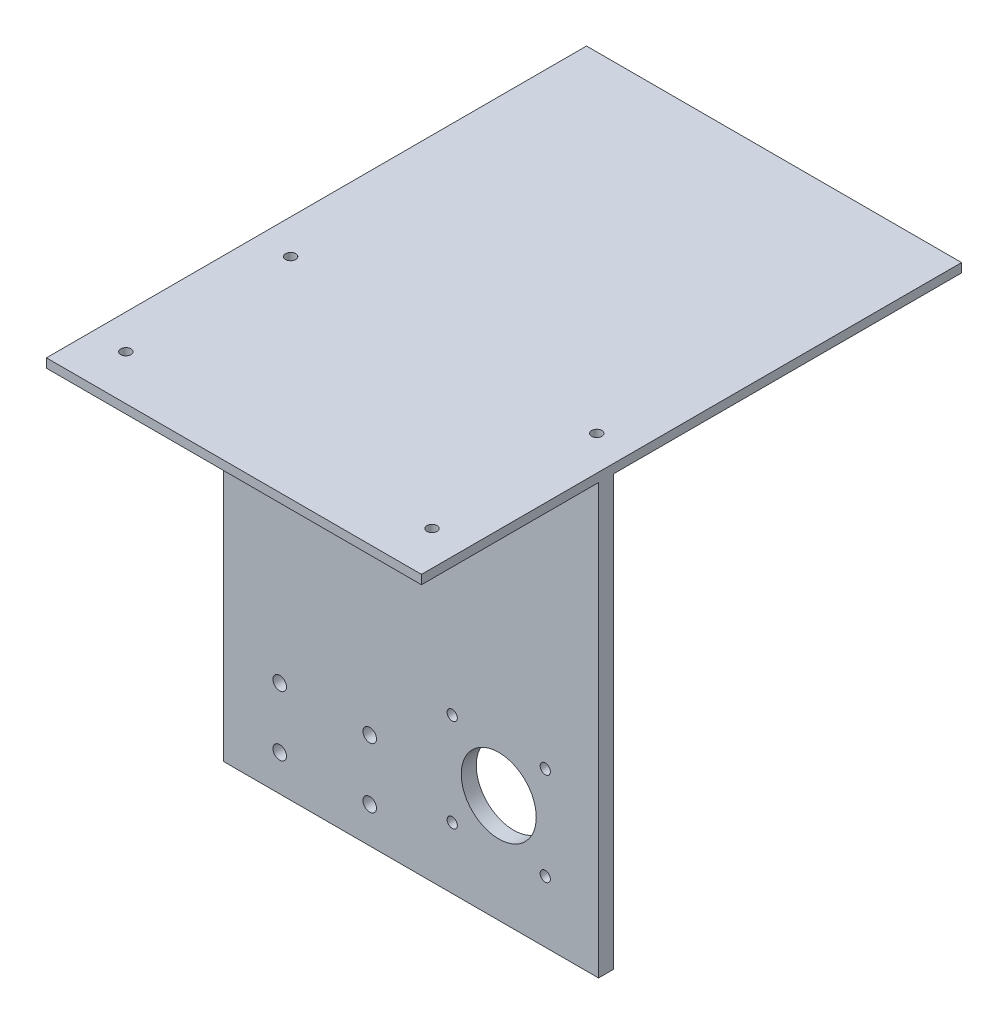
SolidWorks part; units mm, degrees
ref_plane "Piano frontale" through (0, 0, 0) normal (0, 0, 1) x (1, 0, 0)
ref_plane "Piano superiore" through (0, 0, 0) normal (0, 1, 0) x (1, 0, 0)
ref_plane "Piano destro" through (0, 0, 0) normal (1, 0, 0) x (0, 0, -1)
sketch "Schizzo1" plane through (0, 0, 0) normal (0, 0, 1) x (1, 0, 0)
  line L1 (-62.5, 70) -> (62.5, 70)
  line L2 (-62.5, 70) -> (-62.5, -70)
  line L3 (-62.5, -70) -> (62.5, -70)
  line L4 (62.5, 70) -> (62.5, -70)
  line L5 (-62.5, 70) -> (62.5, -70) construction
  line L6 (-62.5, -70) -> (62.5, 70) construction
  point P0 (0, 0)
  dimension "D1" = 125
  dimension "D2" = 140
extrude "Estrusione-Estrusione1" add sketch "Schizzo1" along normal blind 5
hole_wizard "Foro per Vite M4-1" positions "Schizzo3" profile "Schizzo4" hole size "M4" standard "ISO"
sketch "Schizzo3" plane through (0, 0, 5) normal (0, 0, 1) x (1, 0, 0)
  line L0 (-62.5, -70) -> (62.5, -70) construction
  point P0 (-43.75, -38)
  point P2 (-13.75, -38)
  point P4 (-43.75, -58)
  point P6 (-13.75, -58)
sketch "Schizzo4" plane through (-43.75, -38, 5) normal (1, 0, 0) x (0, -1, 0)
  line L0 (0, 0) -> (0, 5)
  line L1 (0, 5) -> (2.25, 5)
  line L2 (2.25, 5) -> (2.25, 0)
  line L5 (2.25, 0) -> (0, 0)
  line L11 (0, -6.35) -> (0, 107.95) construction
  dimension "Thru Hole Dia." = 4.5
  dimension "Thru Hole Depth" = 5
hole_wizard "Foro per Vite M3-2" positions "Schizzo5" profile "Schizzo6" hole size "M3" standard "ISO"
sketch "Schizzo5" plane through (0, 0, 5) normal (0, 0, 1) x (1, 0, 0)
  line L0 (-62.5, -70) -> (62.5, -70) construction
  line L1 (-12.75, 41) -> (-12.75, 63.9107) construction
  line L3 (-12.75, 41) -> (-23.8454, 60.2178) construction
  circle A0 centre (-12.75, 41) radius 15
  point P0 (13.75, -18.5)
  point P2 (44.75, -18.5)
  point P4 (13.75, -49.5)
  point P6 (44.75, -49.5)
  point P8 (-20.25, 53.9904)
  point P44 (2.25, 41)
  point P45 (-20.25, 28.0096)
sketch "Schizzo6" plane through (13.75, -18.5, 5) normal (1, 0, 0) x (0, -1, 0)
  line L0 (0, 0) -> (0, 5)
  line L1 (0, 5) -> (1.7, 5)
  line L2 (1.7, 5) -> (1.7, 0)
  line L5 (1.7, 0) -> (0, 0)
  line L11 (0, -6.35) -> (0, 107.95) construction
  dimension "Thru Hole Dia." = 3.4
  dimension "Thru Hole Depth" = 5
sketch "Schizzo7" plane through (0, 0, 5) normal (0, 0, 1) x (1, 0, 0)
  line L0 (-62.5, -70) -> (62.5, -70) construction
  circle A0 centre (-12.75, 41) radius 11
extrude "Taglio-Estrusione1" cut sketch "Schizzo7" against normal through all
sketch "Schizzo8" plane through (0, 0, 5) normal (0, 0, 1) x (1, 0, 0)
  line L0 (-62.5, -70) -> (62.5, -70) construction
  circle A0 centre (29.25, -34) radius 12.5
extrude "Taglio-Estrusione2" cut sketch "Schizzo8" against normal through all
sketch "Schizzo13" plane through (0, 70, 0) normal (0, 1, 0) x (1, 0, 0)
  line L1 (-62.5, 0) -> (62.5, 0)
  line L2 (-62.5, 0) -> (-62.5, -5)
  line L3 (-62.5, -5) -> (62.5, -5)
  line L4 (62.5, 0) -> (62.5, -5)
extrude "Estrusione-Estrusione3" add sketch "Schizzo13" along normal blind 3
sketch "Schizzo14" plane through (0, 73, 0) normal (0, 1, 0) x (1, 0, 0)
  line L0 (-62.5, -5) -> (62.5, -5) construction
  line L1 (-62.5, 116) -> (62.5, 116)
  line L2 (-62.5, 116) -> (-62.5, -64)
  line L3 (-62.5, -64) -> (62.5, -64)
  line L4 (62.5, 116) -> (62.5, -64)
  dimension "D1" = 125
  dimension "D2" = 180
  dimension "D3" = 121
  dimension "D4" = 62.5
extrude "Estrusione-Estrusione4" add sketch "Schizzo14" along normal blind 3
hole_wizard "Foro per Vite M3-3" positions "Schizzo15" profile "Schizzo16" hole size "M3" standard "ISO"
sketch "Schizzo15" plane through (0, 76, 0) normal (0, 1, 0) x (1, 0, 0)
  line L1 (-51.02, -49) -> (51.02, -49)
  line L2 (-51.02, -49) -> (-51.02, 5.9)
  line L3 (-51.02, 5.9) -> (51.02, 5.9)
  line L4 (51.02, -49) -> (51.02, 5.9)
  line L5 (-62.5, -64) -> (62.5, -64) construction
  point P1 (-51.02, -49)
  point P2 (51.02, 5.9)
  point P145 (-51.02, 5.9)
  point P146 (51.02, -49)
sketch "Schizzo16" plane through (-51.02, 76, 49) normal (1, 0, 0) x (0, 0, 1)
  line L0 (0, 0) -> (0, 3)
  line L1 (0, 3) -> (1.7, 3)
  line L2 (1.7, 3) -> (1.7, 0)
  line L5 (1.7, 0) -> (0, 0)
  line L11 (0, -6.35) -> (0, 107.95) construction
  dimension "Thru Hole Dia." = 3.4
  dimension "Thru Hole Depth" = 3
sketch "Schizzo17" plane through (0, 76, 0) normal (0, 1, 0) x (1, 0, 0)
  line L0 (62.5, 116) -> (-62.5, 116) construction
  line L1 (-40, 106) -> (40, 106)
  line L2 (-40, 106) -> (-40, 26)
  line L3 (-40, 26) -> (40, 26)
  line L4 (40, 106) -> (40, 26)
equation "\"D2@Schizzo3\"=27.5/2"
equation "\"D9@Schizzo5\"=27.5/2-1"
equation "\"D3@Schizzo7\"=27.5/2-1"
equation "\"D1@Schizzo5\"=27.5/2"
equation "\"D2@Schizzo8\"=13.75+31/2"
equation "\"D3@Schizzo8\"=14.85+5.65+31/2"
equation "\"D2@Schizzo5\"=14.85+5.65"
equation "\"D4@Schizzo15\"=\"D3@Schizzo15\"/2"
equation "\"D4@Schizzo17\"=\"D2@Schizzo17\"/2"
equation "\"D3@Schizzo15\"=108.04-2*3"
equation "\"D2@Schizzo15\"=61.74-2*3.42"
